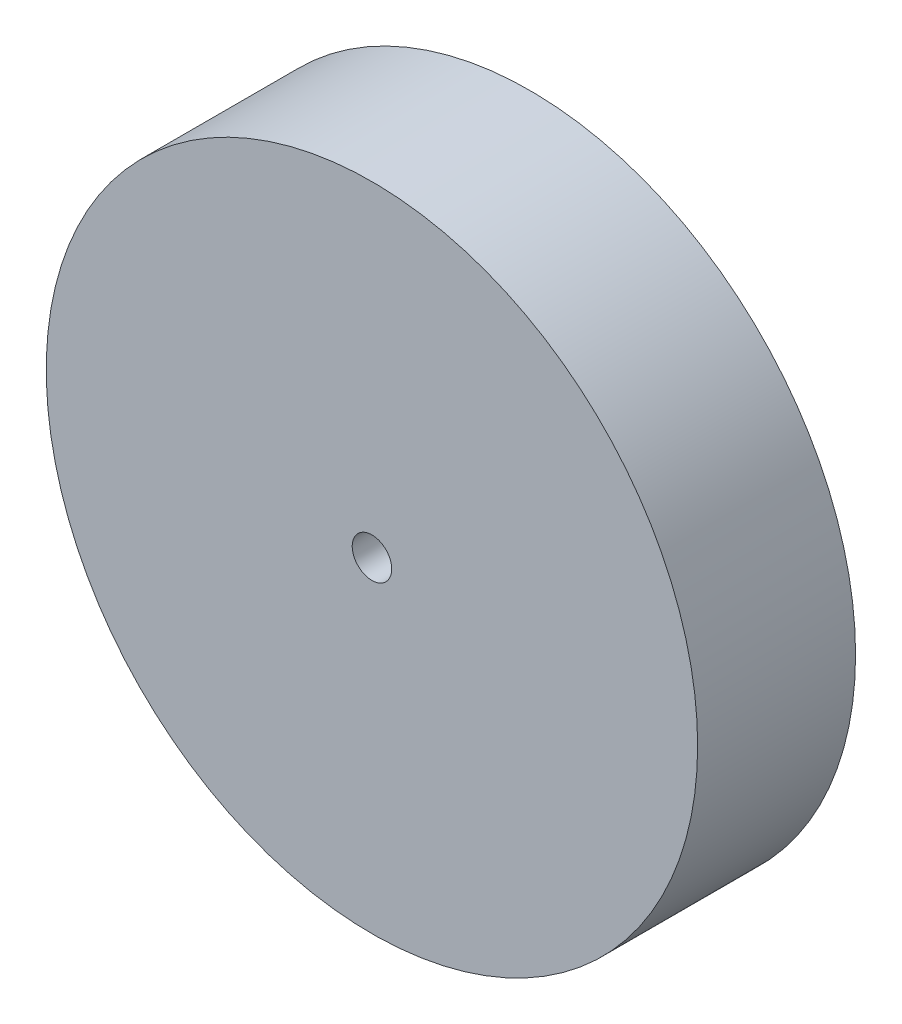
SolidWorks part; units mm, degrees
ref_plane "Plan de face" through (0, 0, 0) normal (0, 0, 1) x (1, 0, 0)
ref_plane "Plan de dessus" through (0, 0, 0) normal (0, 1, 0) x (1, 0, 0)
ref_plane "Plan de droite" through (0, 0, 0) normal (1, 0, 0) x (0, 0, -1)
sketch "Esquisse1" plane through (0, 0, 0) normal (0, 0, 1) x (1, 0, 0)
  circle A0 centre (0, 0) radius 8.25
  circle A1 centre (0, 0) radius 0.5
  dimension "D1" = 1
  dimension "D2" = 16.5
extrude "Boss.-Extru.1" add sketch "Esquisse1" along normal blind 4
